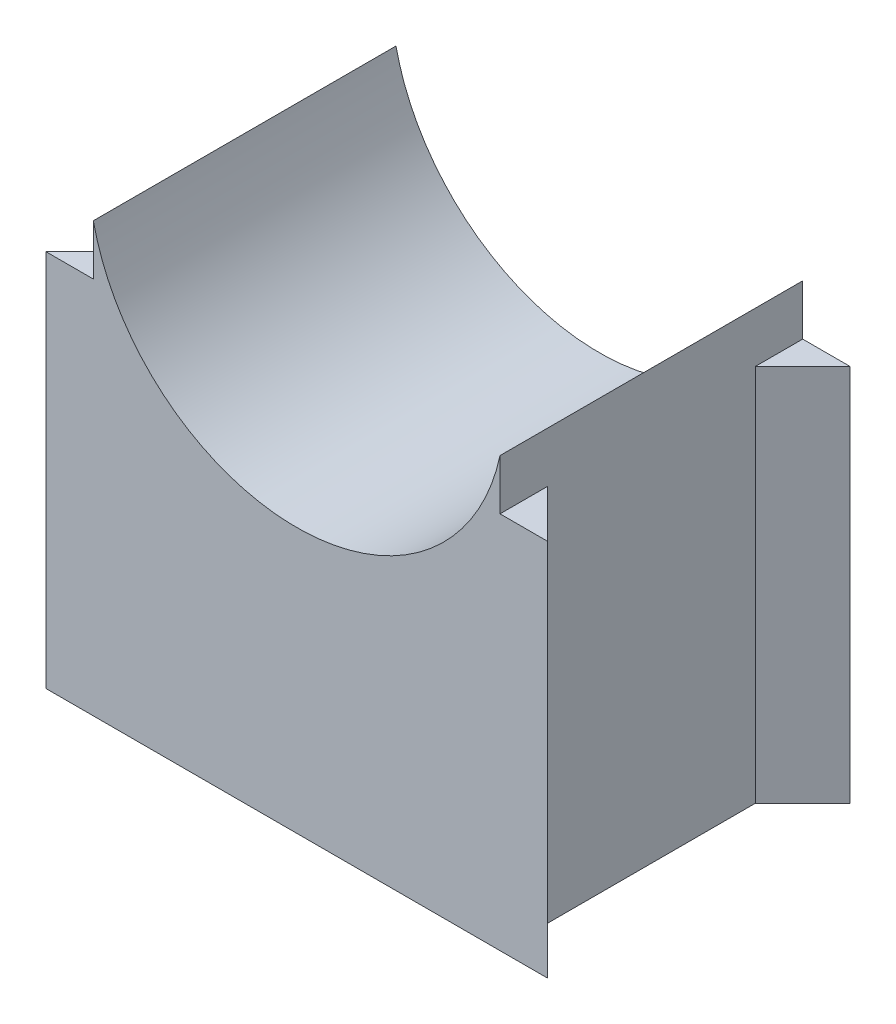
SolidWorks part; units mm, degrees
ref_plane "Ebene vorne" through (0, 0, 0) normal (0, 0, 1) x (1, 0, 0)
ref_plane "Ebene oben" through (0, 0, 0) normal (0, 1, 0) x (1, 0, 0)
ref_plane "Ebene rechts" through (0, 0, 0) normal (1, 0, 0) x (0, 0, -1)
sketch "Skizze3" plane through (0, 0, 0) normal (0, 0, 1) x (1, 0, 0)
  line L0 (0, 0) -> (0, 25) construction
  line L1 (10.75, 0) -> (-10.75, 0)
  line L2 (-10.75, 0) -> (-10.75, 22.6682)
  line L3 (10.75, 0) -> (10.75, 22.6682)
  arc A0 (-10.75, 22.6682) -> (10.75, 22.6682) centre (0, 25) ccw
  dimension "D2" = 22
  dimension "D1" = 25
  dimension "D3" = 21.5
extrude "Aufsatz-Linear austragen1" add sketch "Skizze3" along normal blind 16
sketch "Skizze4" plane through (0, 0, 0) normal (0, -1, 0) x (-1, 0, 0)
  line L0 (0, -16) -> (0, 0) construction
  line L1 (10.75, -16) -> (-10.75, -16) construction
  line L2 (10.75, 0) -> (-10.75, 0) construction
  line L3 (-10.75, -8) -> (10.75, -8) construction
  line L4 (-10.75, -16) -> (-10.75, 0) construction
  line L5 (10.75, -16) -> (10.75, 0) construction
  line L6 (10.75, -16) -> (13.25, -16)
  line L7 (13.25, -16) -> (10.75, -13.5)
  line L8 (10.75, -13.5) -> (10.75, -16)
  line L9 (13.25, 0) -> (10.75, -2.5)
  line L10 (10.75, 0) -> (13.25, 0)
  line L11 (10.75, -2.5) -> (10.75, 0)
  line L12 (-10.75, 0) -> (-13.25, 0)
  line L13 (-10.75, -2.5) -> (-10.75, 0)
  line L14 (-13.25, 0) -> (-10.75, -2.5)
  line L15 (-13.25, -16) -> (-10.75, -13.5)
  line L16 (-10.75, -16) -> (-13.25, -16)
  line L17 (-10.75, -13.5) -> (-10.75, -16)
  dimension "D1" = 2.5
extrude "Aufsatz-Linear austragen2" add sketch "Skizze4" against normal blind 20
